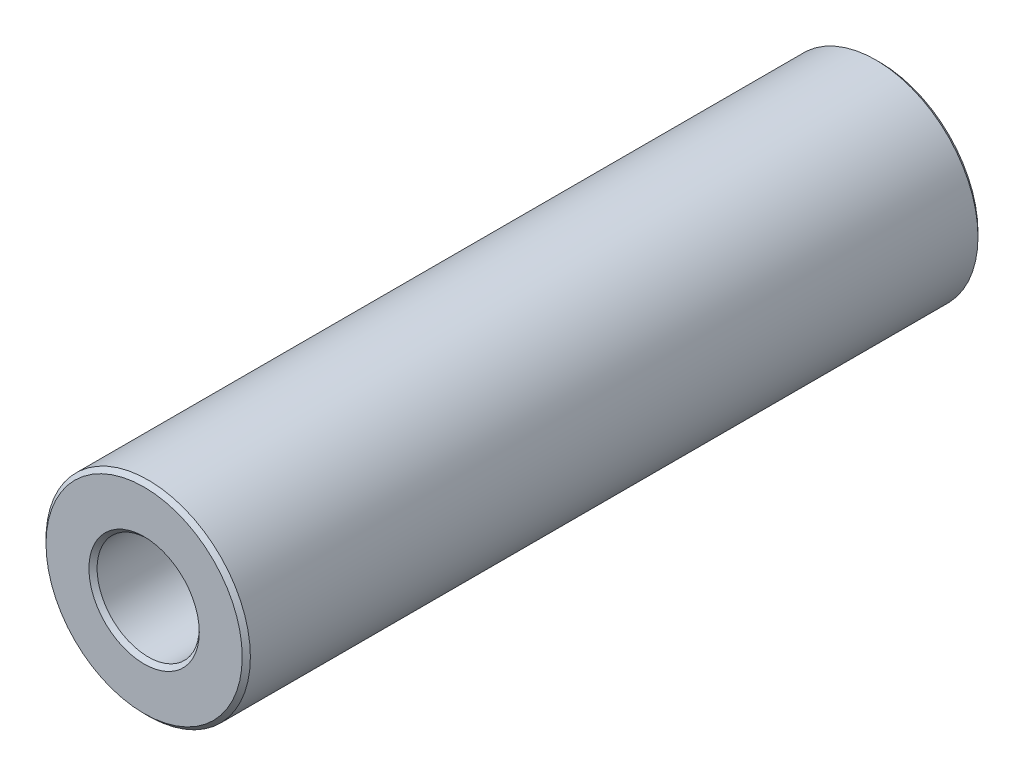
SolidWorks part; units mm, degrees
ref_plane "Front Plane" through (0, 0, 0) normal (0, 0, 1) x (1, 0, 0)
ref_plane "Top Plane" through (0, 0, 0) normal (0, 1, 0) x (1, 0, 0)
ref_plane "Right Plane" through (0, 0, 0) normal (1, 0, 0) x (0, 0, -1)
sketch "Sketch1" plane through (0, 0, 0) normal (0, 0, 1) x (1, 0, 0)
  circle A0 centre (0, 0) radius 2.5
  circle A1 centre (0, 0) radius 1.25
  dimension "D1" = 5
  dimension "D2" = 2.5
extrude "Boss-Extrude2" add sketch "Sketch1" along normal mid plane 18
chamfer "Chamfer3" distance 0.1 angle 45 4 edges at (2.5, 0, 9) (2.5, 0, -9) (1.25, 0, -9) (1.25, 0, 9)
